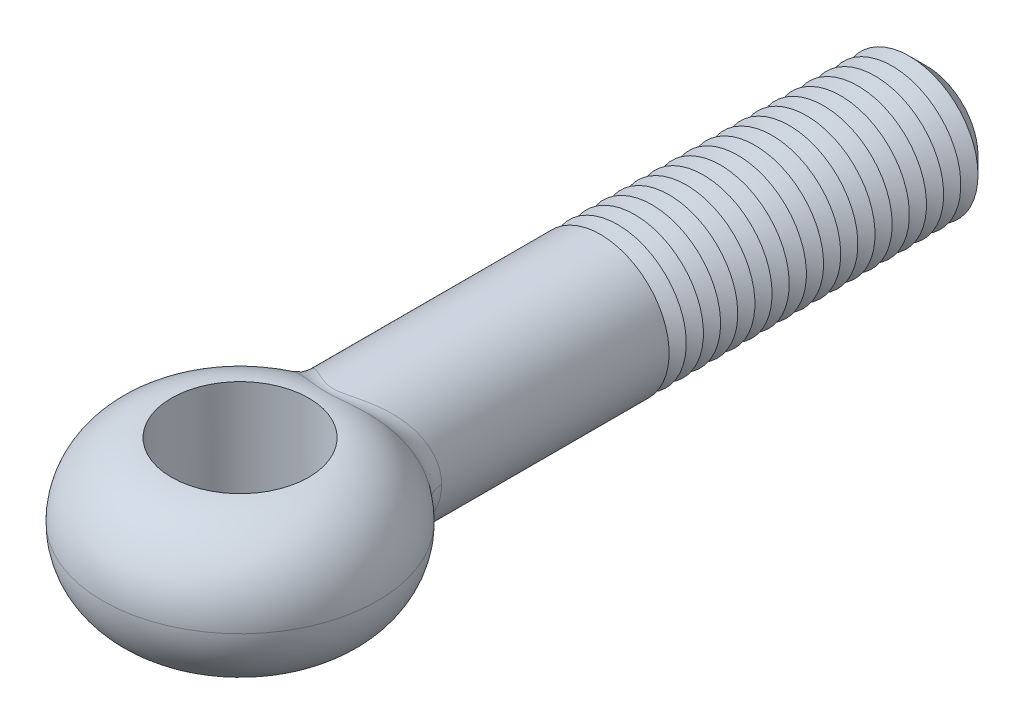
SolidWorks part; units mm, degrees
ref_plane "Front Plane" through (0, 0, 0) normal (0, 0, 1) x (1, 0, 0)
ref_plane "Top Plane" through (0, 0, 0) normal (0, 1, 0) x (1, 0, 0)
ref_plane "Right Plane" through (0, 0, 0) normal (1, 0, 0) x (0, 0, -1)
sketch "Sketch7" plane through (0, 0, 0) normal (0, 1, 0) x (1, 0, 0)
  circle A0 centre (0, 0) radius 16
  dimension "D1" = 32
extrude "Boss-Extrude3" add sketch "Sketch7" along normal mid plane 17
sketch "Sketch8" plane through (0, 0, 0) normal (0, 0, 1) x (1, 0, 0)
  circle A0 centre (0, 0) radius 8
  dimension "D1" = 16
extrude "Boss-Extrude4" add sketch "Sketch8" against normal blind 80
fillet "Fillet5" radius 8.5 2 edges at (0, -8.5, 16) (0, 8.5, 16)
fillet "Fillet6" radius 3 2 edges at (-0.1803, -7.998, -10.3764) (0.1803, 7.998, -10.3764)
chamfer "Chamfer1" distance 2 angle 45 1 edges at (8, 0, -80)
sketch "Sketch10" plane through (0, 0, 0) normal (0, 1, 0) x (1, 0, 0)
  line L0 (0, 28.1405) -> (0, -7.9233) construction
sketch "Sketch11" plane through (0, 0, 0) normal (0, 1, 0) x (1, 0, 0)
  line L0 (-8, 42) -> (-6.2679, 43)
  line L1 (-8, 78) -> (-8, 15.4919) construction
  line L2 (-6.2679, 43) -> (-8, 44)
  line L3 (-8, 44) -> (-8, 42)
  line L4 (6, 80) -> (-6, 80) construction
  dimension "D1" = 2
  dimension "D2" = 38
revolve "Cut-Revolve1" cut sketch "Sketch11" angle 360 about L0
pattern_linear "LPattern1" count 18 spacing 2 along (0, 0, -1) of "Cut-Revolve1"
sketch "Sketch12" plane through (0, 0, 0) normal (0, 1, 0) x (1, 0, 0)
  circle A0 centre (0, 0) radius 8
  dimension "D1" = 16
extrude "Cut-Extrude1" cut sketch "Sketch12" against normal mid plane 17
